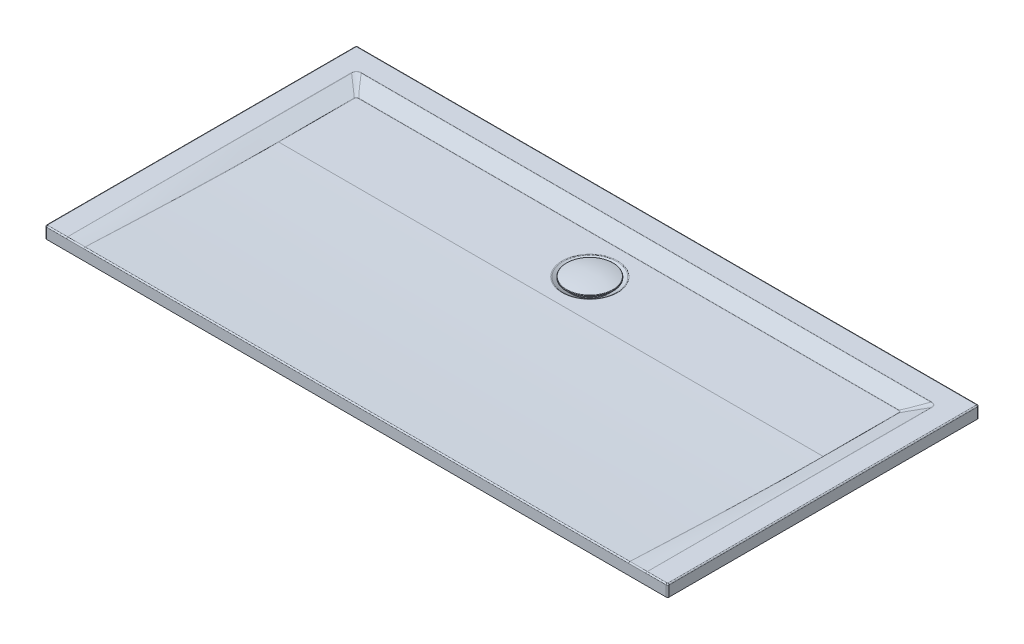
SolidWorks part; units mm, degrees
ref_plane "Płaszczyzna przednia" through (0, 0, 0) normal (0, 0, 1) x (1, 0, 0)
ref_plane "Płaszczyzna górna" through (0, 0, 0) normal (0, 1, 0) x (1, 0, 0)
ref_plane "Płaszczyzna prawa" through (0, 0, 0) normal (1, 0, 0) x (0, 0, -1)
sketch "Szkic1" plane through (0, 0, 0) normal (0, 1, 0) x (1, 0, 0)
  line L0 (0, 400) -> (0, -400) construction
  line L1 (-800, 400) -> (800, 400)
  line L2 (-800, 400) -> (-800, -400)
  line L3 (-800, -400) -> (800, -400)
  line L4 (800, 400) -> (800, -400)
  line L5 (-745, -400) -> (-745, 345)
  line L6 (-745, 345) -> (745, 345)
  line L7 (745, 345) -> (745, -400)
  line L8 (-700, -400) -> (-700, 300)
  line L9 (-700, 300) -> (700, 300)
  line L10 (700, 300) -> (700, -400)
  circle A0 centre (0, 200) radius 45
  circle A1 centre (0, 200) radius 70
  point P9 (0, 345)
  dimension "D6" = 90
  dimension "D7" = 140
  dimension "D1" = 1600
  dimension "D2" = 55
  dimension "D3" = 55
  dimension "D5" = 200
  dimension "D8" = 800
  dimension "D4" = 45
sketch "Szkic2" plane through (0, 0, 0) normal (0, 1, 0) x (1, 0, 0)
  line L0 (-800, -400) -> (800, -400) construction
  line L1 (800, 400) -> (800, -400) construction
  line L2 (745, 345) -> (745, -400) construction
  line L3 (-745, 345) -> (745, 345) construction
  line L4 (-800, 400) -> (800, 400) construction
  line L5 (-745, -400) -> (-745, 345) construction
  line L6 (-800, 400) -> (-800, -400) construction
  line L7 (-800, -400) -> (-745, -400)
  line L8 (800, 400) -> (800, -400)
  line L9 (745, 345) -> (745, -400)
  line L10 (-745, 345) -> (745, 345)
  line L11 (-800, 400) -> (800, 400)
  line L12 (-745, -400) -> (-745, 345)
  line L13 (-800, 400) -> (-800, -400)
  line L14 (745, -400) -> (800, -400)
surface "Powierzchnia-Płaszczyzna1" sketch "Szkic2"
ref_plane "Płaszczyzna1" through (0, -15, 0) normal (0, 1, 0) x (-1, 0, 0)
sketch "Szkic3" plane through (0, -15, 0) normal (0, 1, 0) x (-1, 0, 0)
  line L0 (700, -100) -> (-700, -100)
  line L1 (700, 400) -> (700, -300) construction
  line L2 (-700, -300) -> (-700, 400) construction
  line L3 (0, -100) -> (0, -300) construction
  line L4 (700, -300) -> (-700, -300) construction
  line L5 (-700, -300) -> (-700, -100)
  line L6 (700, -100) -> (700, -300)
  line L7 (700, -300) -> (-700, -300)
  circle A0 centre (0, -200) radius 70 construction
  circle A1 centre (0, -200) radius 70
  point P10 (0, -200)
surface "Powierzchnia-Płaszczyzna2" sketch "Szkic3"
sketch "Szkic4" plane through (0, 0, 0) normal (0, 1, 0) x (1, 0, 0)
  line L0 (700, -400) -> (-700, -400)
other "Granica-Powierzchnia1"
other "Granica-Powierzchnia2"
other "Granica-Powierzchnia3"
mirror "Lustro1" about plane through (0, 0, 0) normal (1, 0, 0)
sketch "Szkic5" plane through (0, 0, 0) normal (0, 1, 0) x (1, 0, 0)
  line L0 (800, 400) -> (800, -400) construction
  line L1 (-800, 400) -> (800, 400) construction
  line L2 (-800, 400) -> (-800, -400) construction
  line L3 (-800, -400) -> (800, -400) construction
  line L4 (800, 400) -> (800, -400)
  line L5 (-800, 400) -> (800, 400)
  line L6 (-800, 400) -> (-800, -400)
  line L7 (-800, -400) -> (800, -400)
surface "Powierzchnia-Wyciągnięcie1" sketch "Szkic5" parameters "D1"=30
sketch "Szkic7" plane through (0, 0, 0) normal (1, 0, 0) x (0, 0, -1)
  line L0 (200, 0) -> (200, -30) construction
  line L1 (400, -30) -> (-400, -30) construction
  line L2 (245, -30) -> (245, -28)
  line L3 (245, -28) -> (249, -28)
  line L6 (249, -28) -> (270, -15)
  dimension "D1" = 90
  dimension "D2" = 2
  dimension "D3" = 98
surface "Powierzchnia-Obrót wokół linii środkowej1" sketch "Szkic7" parameters "D1"=360
surface "Powierzchnia-Płaszczyzna3"
surface "Powierzchnia-Połącz1"
fillet "Zaokrąglenie1" radius 4 6 edges at (0, -28, -249) (0, -15, -130) (800, -15, 400) (800, -15, -400) (-800, -15, -400) (-800, -15, 400)
fillet "Zmienne zaokrąglenie1" radius 40 2 edges at (722.5, -7.5, -322.5)
fillet "Zaokrąglenie3" radius 3 12 edges
fillet "Zaokrąglenie4" radius 3 12 edges at (-798.8284, 0, -398.8284) (0, 0, -400) (798.8284, 0, -398.8284) (800, 0, 0) (798.8284, 0, 398.8284) (770.5, 0, 400) (-770.5, 0, 400) (-798.8284, 0, 398.8284) (-800, 0, 0)
sketch "Szkic8" plane through (0, 0, 0) normal (1, 0, 0) x (0, 0, -1)
  line L0 (200, 0) -> (200, -30) construction
  line L1 (200, -5.6601) -> (179.8469, -5.6601) construction
  line L2 (260, -14.7573) -> (260, -17)
  line L3 (260, -17) -> (200, -17)
  line L4 (200, -17) -> (200, -5.6601)
  line L5 (200, -5.6601) -> (199.9922, 95.6514)
  arc A0 (200, -5.6601) -> (259.2694, -13.7943) centre (200, -225.6601) cw
  arc A1 (259.2694, -13.7943) -> (260, -14.7573) centre (259, -14.7573) cw
  point P11 (260, -14)
  dimension "D1" = 220
  dimension "D4" = 1
  dimension "D2" = 60
  dimension "D3" = 3
  dimension "D5" = 13
revolve "Obrót wokół linii środkowej1" add sketch "Szkic8" angle 360 about L4
